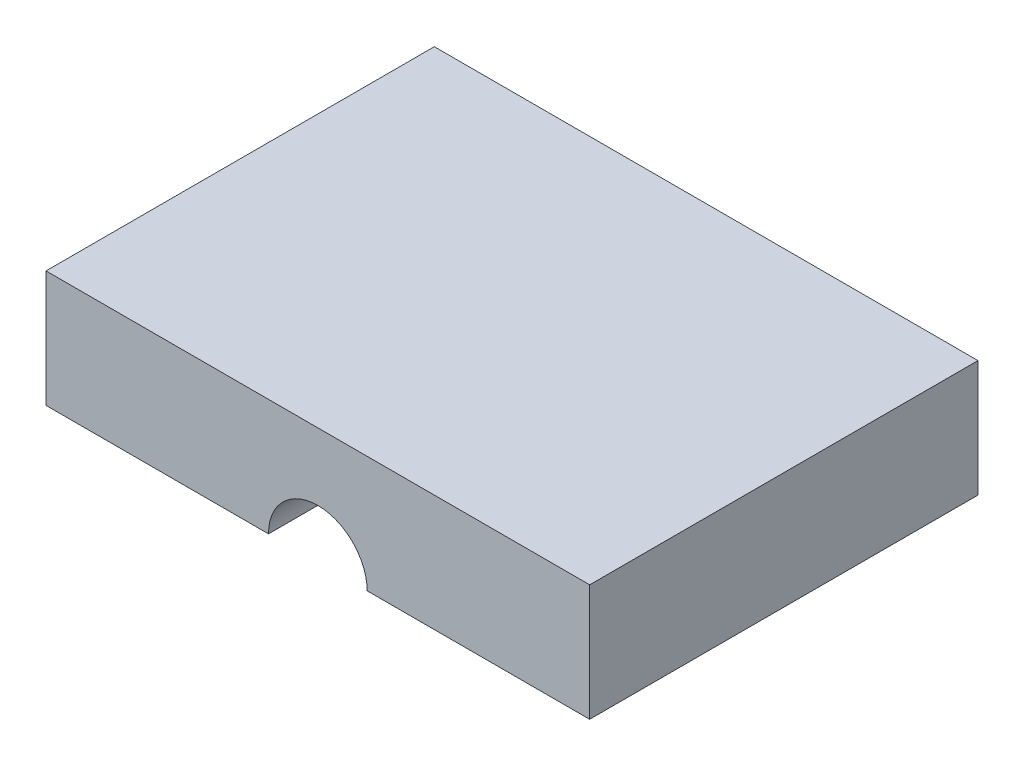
SolidWorks part; units mm, degrees
ref_plane "Front Plane" through (0, 0, 0) normal (0, 0, 1) x (1, 0, 0)
ref_plane "Top Plane" through (0, 0, 0) normal (0, 1, 0) x (1, 0, 0)
ref_plane "Right Plane" through (0, 0, 0) normal (1, 0, 0) x (0, 0, -1)
sketch "Sketch1" plane through (0, 0, 0) normal (0, 0, 1) x (1, 0, 0)
  line L1 (-35, 15) -> (35, 15)
  line L2 (-35, 15) -> (-35, 0)
  line L4 (35, 15) -> (35, 0)
  line L8 (-35, 0) -> (35, 0)
  arc A0 (6.35, 0) -> (-6.35, 0) centre (0, 0) ccw
  point P0 (0, 0)
  dimension "D1" = 12.7
  dimension "D2" = 15
  dimension "D3" = 70
extrude "Boss-Extrude1" add sketch "Sketch1" along normal blind 50 contours A0 L8 L4 L1 L2
